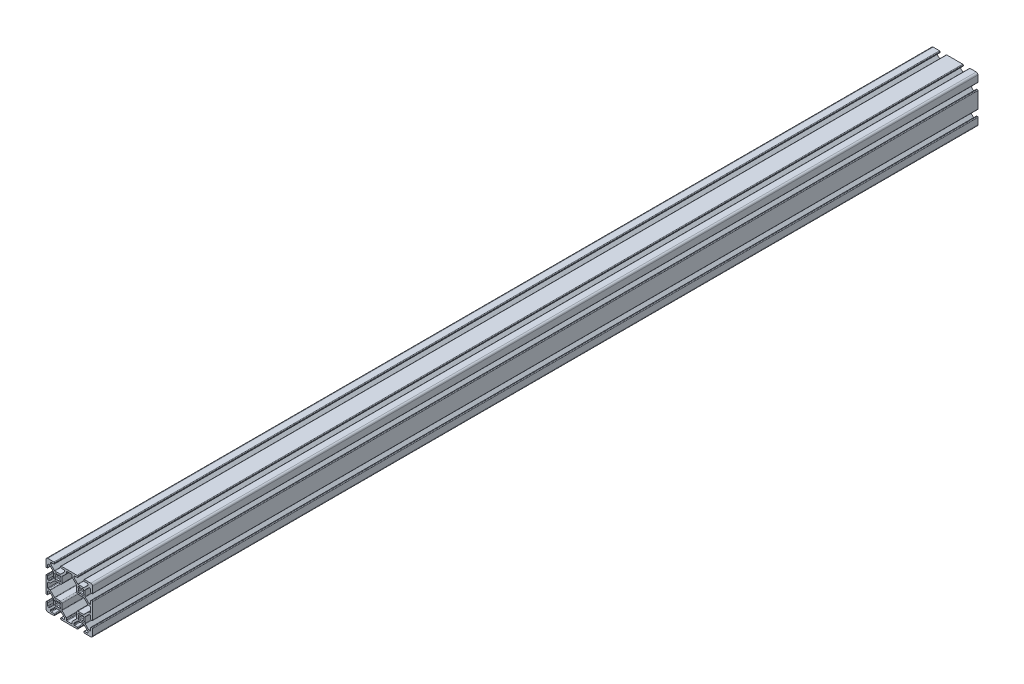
SolidWorks part; units mm, degrees
ref_plane "Front Plane" through (0, 0, 0) normal (0, 0, 1) x (1, 0, 0)
ref_plane "Top Plane" through (0, 0, 0) normal (0, 1, 0) x (1, 0, 0)
ref_plane "Right Plane" through (0, 0, 0) normal (1, 0, 0) x (0, 0, -1)
sketch "Sketch1" plane through (0, 0, 0) normal (0, 0, 1) x (1, 0, 0)
  line L0 (-16.6492, -131.4291) -> (-16.8288, -131.2495)
  line L1 (-16.8288, -126.9997) -> (-16.6492, -126.8201)
  line L2 (-12.3994, -126.8201) -> (-12.2198, -126.9997)
  line L3 (-12.2198, -131.2495) -> (-12.3994, -131.4291)
  line L4 (-36.6492, -131.4291) -> (-36.8288, -131.2495)
  line L5 (-36.8288, -126.9997) -> (-36.6492, -126.8201)
  line L6 (-32.3994, -126.8201) -> (-32.2198, -126.9997)
  line L7 (-32.2198, -131.2495) -> (-32.3994, -131.4291)
  line L8 (-16.6492, -151.4291) -> (-16.8288, -151.2495)
  line L9 (-16.8288, -146.9997) -> (-16.6492, -146.8201)
  line L10 (-12.3994, -146.8201) -> (-12.2198, -146.9997)
  line L11 (-12.2198, -151.2495) -> (-12.3994, -151.4291)
  line L12 (-27.0293, -157.1166) -> (-27.0293, -155.7694)
  line L13 (-27.1781, -155.4102) -> (-30.7205, -151.8677)
  line L14 (-30.8693, -151.5085) -> (-30.8693, -146.6126)
  line L15 (-32.0123, -145.4696) -> (-36.9082, -145.4696)
  line L16 (-37.2674, -145.3208) -> (-40.8098, -141.7784)
  line L17 (-41.169, -141.6296) -> (-42.5163, -141.6296)
  line L18 (-43.0243, -141.1216) -> (-43.0243, -137.1276)
  line L19 (-42.5163, -136.6196) -> (-41.169, -136.6196)
  line L20 (-40.8098, -136.4708) -> (-37.2674, -132.9284)
  line L21 (-36.9082, -132.7796) -> (-32.0123, -132.7796)
  line L22 (-30.8693, -131.6366) -> (-30.8693, -126.7407)
  line L23 (-30.7205, -126.3815) -> (-27.1781, -122.8391)
  line L24 (-27.0293, -122.4798) -> (-27.0293, -121.1326)
  line L25 (-26.5213, -120.6246) -> (-22.5273, -120.6246)
  line L26 (-22.0193, -121.1326) -> (-22.0193, -122.4798)
  line L27 (-21.8705, -122.8391) -> (-18.3281, -126.3815)
  line L28 (-18.1793, -126.7407) -> (-18.1793, -131.6366)
  line L29 (-17.0363, -132.7796) -> (-12.1404, -132.7796)
  line L30 (-11.7812, -132.9284) -> (-8.2387, -136.4708)
  line L31 (-7.8795, -136.6196) -> (-6.5323, -136.6196)
  line L32 (-6.0243, -137.1276) -> (-6.0243, -141.1216)
  line L33 (-6.5323, -141.6296) -> (-7.8795, -141.6296)
  line L34 (-8.2387, -141.7784) -> (-11.7812, -145.3208)
  line L35 (-12.1404, -145.4696) -> (-17.0363, -145.4696)
  line L36 (-18.1793, -146.6126) -> (-18.1793, -151.5085)
  line L37 (-18.3281, -151.8677) -> (-21.8705, -155.4102)
  line L38 (-22.0193, -155.7694) -> (-22.0193, -157.1166)
  line L39 (-22.5273, -157.6246) -> (-26.5213, -157.6246)
  line L40 (-36.6492, -151.4291) -> (-36.8288, -151.2495)
  line L41 (-36.8288, -146.9997) -> (-36.6492, -146.8201)
  line L42 (-32.3994, -146.8201) -> (-32.2198, -146.9997)
  line L43 (-32.2198, -151.2495) -> (-32.3994, -151.4291)
  line L44 (-36.9082, -152.7796) -> (-32.1404, -152.7796)
  line L45 (-31.7812, -152.9284) -> (-28.6781, -156.0315)
  line L46 (-28.5293, -156.3907) -> (-28.5293, -157.1166)
  line L47 (-29.0373, -157.6246) -> (-31.3863, -157.6246)
  line L48 (-31.8943, -158.1326) -> (-31.8943, -158.6166)
  line L49 (-31.3863, -159.1246) -> (-17.6623, -159.1246)
  line L50 (-17.1543, -158.6166) -> (-17.1543, -158.1326)
  line L51 (-17.6623, -157.6246) -> (-20.0113, -157.6246)
  line L52 (-20.5193, -157.1166) -> (-20.5193, -156.3907)
  line L53 (-20.3705, -156.0315) -> (-17.2674, -152.9284)
  line L54 (-16.9082, -152.7796) -> (-12.1404, -152.7796)
  line L55 (-11.7812, -152.9284) -> (-8.6781, -156.0315)
  line L56 (-8.5293, -156.3907) -> (-8.5293, -157.1166)
  line L57 (-9.0373, -157.6246) -> (-11.3863, -157.6246)
  line L58 (-11.8943, -158.1326) -> (-11.8943, -158.6166)
  line L59 (-11.3863, -159.1246) -> (-6.0243, -159.1246)
  line L60 (-4.5243, -157.6246) -> (-4.5243, -152.2626)
  line L61 (-5.0323, -151.7546) -> (-5.5163, -151.7546)
  line L62 (-6.0243, -152.2626) -> (-6.0243, -154.6116)
  line L63 (-6.5323, -155.1196) -> (-7.2582, -155.1196)
  line L64 (-7.6174, -154.9708) -> (-10.7205, -151.8677)
  line L65 (-10.8693, -151.5085) -> (-10.8693, -146.7407)
  line L66 (-10.7205, -146.3815) -> (-7.6174, -143.2784)
  line L67 (-7.2582, -143.1296) -> (-6.5323, -143.1296)
  line L68 (-6.0243, -143.6376) -> (-6.0243, -145.9866)
  line L69 (-5.5163, -146.4946) -> (-5.0323, -146.4946)
  line L70 (-4.5243, -145.9866) -> (-4.5243, -132.2626)
  line L71 (-5.0323, -131.7546) -> (-5.5163, -131.7546)
  line L72 (-6.0243, -132.2626) -> (-6.0243, -134.6116)
  line L73 (-6.5323, -135.1196) -> (-7.2582, -135.1196)
  line L74 (-7.6174, -134.9708) -> (-10.7205, -131.8677)
  line L75 (-10.8693, -131.5085) -> (-10.8693, -126.7407)
  line L76 (-10.7205, -126.3815) -> (-7.6174, -123.2784)
  line L77 (-7.2582, -123.1296) -> (-6.5323, -123.1296)
  line L78 (-6.0243, -123.6376) -> (-6.0243, -125.9866)
  line L79 (-5.5163, -126.4946) -> (-5.0323, -126.4946)
  line L80 (-4.5243, -125.9866) -> (-4.5243, -120.6246)
  line L81 (-6.0243, -119.1246) -> (-11.3863, -119.1246)
  line L82 (-11.8943, -119.6326) -> (-11.8943, -120.1166)
  line L83 (-11.3863, -120.6246) -> (-9.0373, -120.6246)
  line L84 (-8.5293, -121.1326) -> (-8.5293, -121.8585)
  line L85 (-8.6781, -122.2177) -> (-11.7812, -125.3208)
  line L86 (-12.1404, -125.4696) -> (-16.9082, -125.4696)
  line L87 (-17.2674, -125.3208) -> (-20.3705, -122.2177)
  line L88 (-20.5193, -121.8585) -> (-20.5193, -121.1326)
  line L89 (-20.0113, -120.6246) -> (-17.6623, -120.6246)
  line L90 (-17.1543, -120.1166) -> (-17.1543, -119.6326)
  line L91 (-17.6623, -119.1246) -> (-31.3863, -119.1246)
  line L92 (-31.8943, -119.6326) -> (-31.8943, -120.1166)
  line L93 (-31.3863, -120.6246) -> (-29.0373, -120.6246)
  line L94 (-28.5293, -121.1326) -> (-28.5293, -121.8585)
  line L95 (-28.6781, -122.2177) -> (-31.7812, -125.3208)
  line L96 (-32.1404, -125.4696) -> (-36.9082, -125.4696)
  line L97 (-37.2674, -125.3208) -> (-40.3705, -122.2177)
  line L98 (-40.5193, -121.8585) -> (-40.5193, -121.1326)
  line L99 (-40.0113, -120.6246) -> (-37.6623, -120.6246)
  line L100 (-37.1543, -120.1166) -> (-37.1543, -119.6326)
  line L101 (-37.6623, -119.1246) -> (-43.0243, -119.1246)
  line L102 (-44.5243, -120.6246) -> (-44.5243, -125.9866)
  line L103 (-44.0163, -126.4946) -> (-43.5323, -126.4946)
  line L104 (-43.0243, -125.9866) -> (-43.0243, -123.6376)
  line L105 (-42.5163, -123.1296) -> (-41.7904, -123.1296)
  line L106 (-41.4312, -123.2784) -> (-38.3281, -126.3815)
  line L107 (-38.1793, -126.7407) -> (-38.1793, -131.5085)
  line L108 (-38.3281, -131.8677) -> (-41.4312, -134.9708)
  line L109 (-41.7904, -135.1196) -> (-42.5163, -135.1196)
  line L110 (-43.0243, -134.6116) -> (-43.0243, -132.2626)
  line L111 (-43.5323, -131.7546) -> (-44.0163, -131.7546)
  line L112 (-44.5243, -132.2626) -> (-44.5243, -145.9866)
  line L113 (-44.0163, -146.4946) -> (-43.5323, -146.4946)
  line L114 (-43.0243, -145.9866) -> (-43.0243, -143.6376)
  line L115 (-42.5163, -143.1296) -> (-41.7904, -143.1296)
  line L116 (-41.4312, -143.2784) -> (-38.3281, -146.3815)
  line L117 (-38.1793, -146.7407) -> (-38.1793, -151.5085)
  line L118 (-38.3281, -151.8677) -> (-41.4312, -154.9708)
  line L119 (-41.7904, -155.1196) -> (-42.5163, -155.1196)
  line L120 (-43.0243, -154.6116) -> (-43.0243, -152.2626)
  line L121 (-43.5323, -151.7546) -> (-44.0163, -151.7546)
  line L122 (-44.5243, -152.2626) -> (-44.5243, -157.6246)
  line L123 (-43.0243, -159.1246) -> (-37.6623, -159.1246)
  line L124 (-37.1543, -158.6166) -> (-37.1543, -158.1326)
  line L125 (-37.6623, -157.6246) -> (-40.0113, -157.6246)
  line L126 (-40.5193, -157.1166) -> (-40.5193, -156.3907)
  line L127 (-40.3705, -156.0315) -> (-37.2674, -152.9284)
  arc A0 (-16.4594, -129.9286) -> (-16.8288, -131.2495) centre (-16.2723, -130.693) ccw
  arc A1 (-16.4594, -128.3206) -> (-16.4594, -129.9286) centre (-14.5243, -129.1246) ccw
  arc A2 (-16.8288, -126.9997) -> (-16.4594, -128.3206) centre (-16.2723, -127.5562) ccw
  arc A3 (-15.3283, -127.1895) -> (-16.6492, -126.8201) centre (-16.0927, -127.3766) ccw
  arc A4 (-13.7203, -127.1895) -> (-15.3283, -127.1895) centre (-14.5243, -129.1246) ccw
  arc A5 (-12.3994, -126.8201) -> (-13.7203, -127.1895) centre (-12.9559, -127.3766) ccw
  arc A6 (-12.5892, -128.3206) -> (-12.2198, -126.9997) centre (-12.7763, -127.5562) ccw
  arc A7 (-12.5892, -129.9286) -> (-12.5892, -128.3206) centre (-14.5243, -129.1246) ccw
  arc A8 (-12.2198, -131.2495) -> (-12.5892, -129.9286) centre (-12.7763, -130.693) ccw
  arc A9 (-13.7203, -131.0597) -> (-12.3994, -131.4291) centre (-12.9559, -130.8726) ccw
  arc A10 (-15.3283, -131.0597) -> (-13.7203, -131.0597) centre (-14.5243, -129.1246) ccw
  arc A11 (-16.6492, -131.4291) -> (-15.3283, -131.0597) centre (-16.0927, -130.8726) ccw
  arc A12 (-36.4594, -129.9286) -> (-36.8288, -131.2495) centre (-36.2723, -130.693) ccw
  arc A13 (-36.4594, -128.3206) -> (-36.4594, -129.9286) centre (-34.5243, -129.1246) ccw
  arc A14 (-36.8288, -126.9997) -> (-36.4594, -128.3206) centre (-36.2723, -127.5562) ccw
  arc A15 (-35.3283, -127.1895) -> (-36.6492, -126.8201) centre (-36.0927, -127.3766) ccw
  arc A16 (-33.7203, -127.1895) -> (-35.3283, -127.1895) centre (-34.5243, -129.1246) ccw
  arc A17 (-32.3994, -126.8201) -> (-33.7203, -127.1895) centre (-32.9559, -127.3766) ccw
  arc A18 (-32.5892, -128.3206) -> (-32.2198, -126.9997) centre (-32.7763, -127.5562) ccw
  arc A19 (-32.5892, -129.9286) -> (-32.5892, -128.3206) centre (-34.5243, -129.1246) ccw
  arc A20 (-32.2198, -131.2495) -> (-32.5892, -129.9286) centre (-32.7763, -130.693) ccw
  arc A21 (-33.7203, -131.0597) -> (-32.3994, -131.4291) centre (-32.9559, -130.8726) ccw
  arc A22 (-35.3283, -131.0597) -> (-33.7203, -131.0597) centre (-34.5243, -129.1246) ccw
  arc A23 (-36.6492, -131.4291) -> (-35.3283, -131.0597) centre (-36.0927, -130.8726) ccw
  arc A24 (-16.4594, -149.9286) -> (-16.8288, -151.2495) centre (-16.2723, -150.693) ccw
  arc A25 (-16.4594, -148.3206) -> (-16.4594, -149.9286) centre (-14.5243, -149.1246) ccw
  arc A26 (-16.8288, -146.9997) -> (-16.4594, -148.3206) centre (-16.2723, -147.5562) ccw
  arc A27 (-15.3283, -147.1895) -> (-16.6492, -146.8201) centre (-16.0927, -147.3766) ccw
  arc A28 (-13.7203, -147.1895) -> (-15.3283, -147.1895) centre (-14.5243, -149.1246) ccw
  arc A29 (-12.3994, -146.8201) -> (-13.7203, -147.1895) centre (-12.9559, -147.3766) ccw
  arc A30 (-12.5892, -148.3206) -> (-12.2198, -146.9997) centre (-12.7763, -147.5562) ccw
  arc A31 (-12.5892, -149.9286) -> (-12.5892, -148.3206) centre (-14.5243, -149.1246) ccw
  arc A32 (-12.2198, -151.2495) -> (-12.5892, -149.9286) centre (-12.7763, -150.693) ccw
  arc A33 (-13.7203, -151.0597) -> (-12.3994, -151.4291) centre (-12.9559, -150.8726) ccw
  arc A34 (-15.3283, -151.0597) -> (-13.7203, -151.0597) centre (-14.5243, -149.1246) ccw
  arc A35 (-16.6492, -151.4291) -> (-15.3283, -151.0597) centre (-16.0927, -150.8726) ccw
  arc A36 (-27.0293, -157.1166) -> (-26.5213, -157.6246) centre (-26.5213, -157.1166) ccw
  arc A37 (-27.0293, -155.7694) -> (-27.1781, -155.4102) centre (-27.5373, -155.7694) ccw
  arc A38 (-30.8693, -151.5085) -> (-30.7205, -151.8677) centre (-30.3613, -151.5085) ccw
  arc A39 (-30.8693, -146.6126) -> (-32.0123, -145.4696) centre (-32.0123, -146.6126) ccw
  arc A40 (-37.2674, -145.3208) -> (-36.9082, -145.4696) centre (-36.9082, -144.9616) ccw
  arc A41 (-40.8098, -141.7784) -> (-41.169, -141.6296) centre (-41.169, -142.1376) ccw
  arc A42 (-43.0243, -141.1216) -> (-42.5163, -141.6296) centre (-42.5163, -141.1216) ccw
  arc A43 (-42.5163, -136.6196) -> (-43.0243, -137.1276) centre (-42.5163, -137.1276) ccw
  arc A44 (-41.169, -136.6196) -> (-40.8098, -136.4708) centre (-41.169, -136.1116) ccw
  arc A45 (-36.9082, -132.7796) -> (-37.2674, -132.9284) centre (-36.9082, -133.2876) ccw
  arc A46 (-32.0123, -132.7796) -> (-30.8693, -131.6366) centre (-32.0123, -131.6366) ccw
  arc A47 (-30.7205, -126.3815) -> (-30.8693, -126.7407) centre (-30.3613, -126.7407) ccw
  arc A48 (-27.1781, -122.8391) -> (-27.0293, -122.4798) centre (-27.5373, -122.4798) ccw
  arc A49 (-26.5213, -120.6246) -> (-27.0293, -121.1326) centre (-26.5213, -121.1326) ccw
  arc A50 (-22.0193, -121.1326) -> (-22.5273, -120.6246) centre (-22.5273, -121.1326) ccw
  arc A51 (-22.0193, -122.4798) -> (-21.8705, -122.8391) centre (-21.5113, -122.4798) ccw
  arc A52 (-18.1793, -126.7407) -> (-18.3281, -126.3815) centre (-18.6873, -126.7407) ccw
  arc A53 (-18.1793, -131.6366) -> (-17.0363, -132.7796) centre (-17.0363, -131.6366) ccw
  arc A54 (-11.7812, -132.9284) -> (-12.1404, -132.7796) centre (-12.1404, -133.2876) ccw
  arc A55 (-8.2387, -136.4708) -> (-7.8795, -136.6196) centre (-7.8795, -136.1116) ccw
  arc A56 (-6.0243, -137.1276) -> (-6.5323, -136.6196) centre (-6.5323, -137.1276) ccw
  arc A57 (-6.5323, -141.6296) -> (-6.0243, -141.1216) centre (-6.5323, -141.1216) ccw
  arc A58 (-7.8795, -141.6296) -> (-8.2387, -141.7784) centre (-7.8795, -142.1376) ccw
  arc A59 (-12.1404, -145.4696) -> (-11.7812, -145.3208) centre (-12.1404, -144.9616) ccw
  arc A60 (-17.0363, -145.4696) -> (-18.1793, -146.6126) centre (-17.0363, -146.6126) ccw
  arc A61 (-18.3281, -151.8677) -> (-18.1793, -151.5085) centre (-18.6873, -151.5085) ccw
  arc A62 (-21.8705, -155.4102) -> (-22.0193, -155.7694) centre (-21.5113, -155.7694) ccw
  arc A63 (-22.5273, -157.6246) -> (-22.0193, -157.1166) centre (-22.5273, -157.1166) ccw
  arc A64 (-36.4594, -149.9286) -> (-36.8288, -151.2495) centre (-36.2723, -150.693) ccw
  arc A65 (-36.4594, -148.3206) -> (-36.4594, -149.9286) centre (-34.5243, -149.1246) ccw
  arc A66 (-36.8288, -146.9997) -> (-36.4594, -148.3206) centre (-36.2723, -147.5562) ccw
  arc A67 (-35.3283, -147.1895) -> (-36.6492, -146.8201) centre (-36.0927, -147.3766) ccw
  arc A68 (-33.7203, -147.1895) -> (-35.3283, -147.1895) centre (-34.5243, -149.1246) ccw
  arc A69 (-32.3994, -146.8201) -> (-33.7203, -147.1895) centre (-32.9559, -147.3766) ccw
  arc A70 (-32.5892, -148.3206) -> (-32.2198, -146.9997) centre (-32.7763, -147.5562) ccw
  arc A71 (-32.5892, -149.9286) -> (-32.5892, -148.3206) centre (-34.5243, -149.1246) ccw
  arc A72 (-32.2198, -151.2495) -> (-32.5892, -149.9286) centre (-32.7763, -150.693) ccw
  arc A73 (-33.7203, -151.0597) -> (-32.3994, -151.4291) centre (-32.9559, -150.8726) ccw
  arc A74 (-35.3283, -151.0597) -> (-33.7203, -151.0597) centre (-34.5243, -149.1246) ccw
  arc A75 (-36.6492, -151.4291) -> (-35.3283, -151.0597) centre (-36.0927, -150.8726) ccw
  arc A76 (-36.9082, -152.7796) -> (-37.2674, -152.9284) centre (-36.9082, -153.2876) ccw
  arc A77 (-31.7812, -152.9284) -> (-32.1404, -152.7796) centre (-32.1404, -153.2876) ccw
  arc A78 (-28.5293, -156.3907) -> (-28.6781, -156.0315) centre (-29.0373, -156.3907) ccw
  arc A79 (-29.0373, -157.6246) -> (-28.5293, -157.1166) centre (-29.0373, -157.1166) ccw
  arc A80 (-31.3863, -157.6246) -> (-31.8943, -158.1326) centre (-31.3863, -158.1326) ccw
  arc A81 (-31.8943, -158.6166) -> (-31.3863, -159.1246) centre (-31.3863, -158.6166) ccw
  arc A82 (-17.6623, -159.1246) -> (-17.1543, -158.6166) centre (-17.6623, -158.6166) ccw
  arc A83 (-17.1543, -158.1326) -> (-17.6623, -157.6246) centre (-17.6623, -158.1326) ccw
  arc A84 (-20.5193, -157.1166) -> (-20.0113, -157.6246) centre (-20.0113, -157.1166) ccw
  arc A85 (-20.3705, -156.0315) -> (-20.5193, -156.3907) centre (-20.0113, -156.3907) ccw
  arc A86 (-16.9082, -152.7796) -> (-17.2674, -152.9284) centre (-16.9082, -153.2876) ccw
  arc A87 (-11.7812, -152.9284) -> (-12.1404, -152.7796) centre (-12.1404, -153.2876) ccw
  arc A88 (-8.5293, -156.3907) -> (-8.6781, -156.0315) centre (-9.0373, -156.3907) ccw
  arc A89 (-9.0373, -157.6246) -> (-8.5293, -157.1166) centre (-9.0373, -157.1166) ccw
  arc A90 (-11.3863, -157.6246) -> (-11.8943, -158.1326) centre (-11.3863, -158.1326) ccw
  arc A91 (-11.8943, -158.6166) -> (-11.3863, -159.1246) centre (-11.3863, -158.6166) ccw
  arc A92 (-6.0243, -159.1246) -> (-4.5243, -157.6246) centre (-6.0243, -157.6246) ccw
  arc A93 (-4.5243, -152.2626) -> (-5.0323, -151.7546) centre (-5.0323, -152.2626) ccw
  arc A94 (-5.5163, -151.7546) -> (-6.0243, -152.2626) centre (-5.5163, -152.2626) ccw
  arc A95 (-6.5323, -155.1196) -> (-6.0243, -154.6116) centre (-6.5323, -154.6116) ccw
  arc A96 (-7.6174, -154.9708) -> (-7.2582, -155.1196) centre (-7.2582, -154.6116) ccw
  arc A97 (-10.8693, -151.5085) -> (-10.7205, -151.8677) centre (-10.3613, -151.5085) ccw
  arc A98 (-10.7205, -146.3815) -> (-10.8693, -146.7407) centre (-10.3613, -146.7407) ccw
  arc A99 (-7.2582, -143.1296) -> (-7.6174, -143.2784) centre (-7.2582, -143.6376) ccw
  arc A100 (-6.0243, -143.6376) -> (-6.5323, -143.1296) centre (-6.5323, -143.6376) ccw
  arc A101 (-6.0243, -145.9866) -> (-5.5163, -146.4946) centre (-5.5163, -145.9866) ccw
  arc A102 (-5.0323, -146.4946) -> (-4.5243, -145.9866) centre (-5.0323, -145.9866) ccw
  arc A103 (-4.5243, -132.2626) -> (-5.0323, -131.7546) centre (-5.0323, -132.2626) ccw
  arc A104 (-5.5163, -131.7546) -> (-6.0243, -132.2626) centre (-5.5163, -132.2626) ccw
  arc A105 (-6.5323, -135.1196) -> (-6.0243, -134.6116) centre (-6.5323, -134.6116) ccw
  arc A106 (-7.6174, -134.9708) -> (-7.2582, -135.1196) centre (-7.2582, -134.6116) ccw
  arc A107 (-10.8693, -131.5085) -> (-10.7205, -131.8677) centre (-10.3613, -131.5085) ccw
  arc A108 (-10.7205, -126.3815) -> (-10.8693, -126.7407) centre (-10.3613, -126.7407) ccw
  arc A109 (-7.2582, -123.1296) -> (-7.6174, -123.2784) centre (-7.2582, -123.6376) ccw
  arc A110 (-6.0243, -123.6376) -> (-6.5323, -123.1296) centre (-6.5323, -123.6376) ccw
  arc A111 (-6.0243, -125.9866) -> (-5.5163, -126.4946) centre (-5.5163, -125.9866) ccw
  arc A112 (-5.0323, -126.4946) -> (-4.5243, -125.9866) centre (-5.0323, -125.9866) ccw
  arc A113 (-4.5243, -120.6246) -> (-6.0243, -119.1246) centre (-6.0243, -120.6246) ccw
  arc A114 (-11.3863, -119.1246) -> (-11.8943, -119.6326) centre (-11.3863, -119.6326) ccw
  arc A115 (-11.8943, -120.1166) -> (-11.3863, -120.6246) centre (-11.3863, -120.1166) ccw
  arc A116 (-8.5293, -121.1326) -> (-9.0373, -120.6246) centre (-9.0373, -121.1326) ccw
  arc A117 (-8.6781, -122.2177) -> (-8.5293, -121.8585) centre (-9.0373, -121.8585) ccw
  arc A118 (-12.1404, -125.4696) -> (-11.7812, -125.3208) centre (-12.1404, -124.9616) ccw
  arc A119 (-17.2674, -125.3208) -> (-16.9082, -125.4696) centre (-16.9082, -124.9616) ccw
  arc A120 (-20.5193, -121.8585) -> (-20.3705, -122.2177) centre (-20.0113, -121.8585) ccw
  arc A121 (-20.0113, -120.6246) -> (-20.5193, -121.1326) centre (-20.0113, -121.1326) ccw
  arc A122 (-17.6623, -120.6246) -> (-17.1543, -120.1166) centre (-17.6623, -120.1166) ccw
  arc A123 (-17.1543, -119.6326) -> (-17.6623, -119.1246) centre (-17.6623, -119.6326) ccw
  arc A124 (-31.3863, -119.1246) -> (-31.8943, -119.6326) centre (-31.3863, -119.6326) ccw
  arc A125 (-31.8943, -120.1166) -> (-31.3863, -120.6246) centre (-31.3863, -120.1166) ccw
  arc A126 (-28.5293, -121.1326) -> (-29.0373, -120.6246) centre (-29.0373, -121.1326) ccw
  arc A127 (-28.6781, -122.2177) -> (-28.5293, -121.8585) centre (-29.0373, -121.8585) ccw
  arc A128 (-32.1404, -125.4696) -> (-31.7812, -125.3208) centre (-32.1404, -124.9616) ccw
  arc A129 (-37.2674, -125.3208) -> (-36.9082, -125.4696) centre (-36.9082, -124.9616) ccw
  arc A130 (-40.5193, -121.8585) -> (-40.3705, -122.2177) centre (-40.0113, -121.8585) ccw
  arc A131 (-40.0113, -120.6246) -> (-40.5193, -121.1326) centre (-40.0113, -121.1326) ccw
  arc A132 (-37.6623, -120.6246) -> (-37.1543, -120.1166) centre (-37.6623, -120.1166) ccw
  arc A133 (-37.1543, -119.6326) -> (-37.6623, -119.1246) centre (-37.6623, -119.6326) ccw
  arc A134 (-43.0243, -119.1246) -> (-44.5243, -120.6246) centre (-43.0243, -120.6246) ccw
  arc A135 (-44.5243, -125.9866) -> (-44.0163, -126.4946) centre (-44.0163, -125.9866) ccw
  arc A136 (-43.5323, -126.4946) -> (-43.0243, -125.9866) centre (-43.5323, -125.9866) ccw
  arc A137 (-42.5163, -123.1296) -> (-43.0243, -123.6376) centre (-42.5163, -123.6376) ccw
  arc A138 (-41.4312, -123.2784) -> (-41.7904, -123.1296) centre (-41.7904, -123.6376) ccw
  arc A139 (-38.1793, -126.7407) -> (-38.3281, -126.3815) centre (-38.6873, -126.7407) ccw
  arc A140 (-38.3281, -131.8677) -> (-38.1793, -131.5085) centre (-38.6873, -131.5085) ccw
  arc A141 (-41.7904, -135.1196) -> (-41.4312, -134.9708) centre (-41.7904, -134.6116) ccw
  arc A142 (-43.0243, -134.6116) -> (-42.5163, -135.1196) centre (-42.5163, -134.6116) ccw
  arc A143 (-43.0243, -132.2626) -> (-43.5323, -131.7546) centre (-43.5323, -132.2626) ccw
  arc A144 (-44.0163, -131.7546) -> (-44.5243, -132.2626) centre (-44.0163, -132.2626) ccw
  arc A145 (-44.5243, -145.9866) -> (-44.0163, -146.4946) centre (-44.0163, -145.9866) ccw
  arc A146 (-43.5323, -146.4946) -> (-43.0243, -145.9866) centre (-43.5323, -145.9866) ccw
  arc A147 (-42.5163, -143.1296) -> (-43.0243, -143.6376) centre (-42.5163, -143.6376) ccw
  arc A148 (-41.4312, -143.2784) -> (-41.7904, -143.1296) centre (-41.7904, -143.6376) ccw
  arc A149 (-38.1793, -146.7407) -> (-38.3281, -146.3815) centre (-38.6873, -146.7407) ccw
  arc A150 (-38.3281, -151.8677) -> (-38.1793, -151.5085) centre (-38.6873, -151.5085) ccw
  arc A151 (-41.7904, -155.1196) -> (-41.4312, -154.9708) centre (-41.7904, -154.6116) ccw
  arc A152 (-43.0243, -154.6116) -> (-42.5163, -155.1196) centre (-42.5163, -154.6116) ccw
  arc A153 (-43.0243, -152.2626) -> (-43.5323, -151.7546) centre (-43.5323, -152.2626) ccw
  arc A154 (-44.0163, -151.7546) -> (-44.5243, -152.2626) centre (-44.0163, -152.2626) ccw
  arc A155 (-44.5243, -157.6246) -> (-43.0243, -159.1246) centre (-43.0243, -157.6246) ccw
  arc A156 (-37.6623, -159.1246) -> (-37.1543, -158.6166) centre (-37.6623, -158.6166) ccw
  arc A157 (-37.1543, -158.1326) -> (-37.6623, -157.6246) centre (-37.6623, -158.1326) ccw
  arc A158 (-40.5193, -157.1166) -> (-40.0113, -157.6246) centre (-40.0113, -157.1166) ccw
  arc A159 (-40.3705, -156.0315) -> (-40.5193, -156.3907) centre (-40.0113, -156.3907) ccw
extrude "Extrude1" add sketch "Sketch1" along normal blind 762
